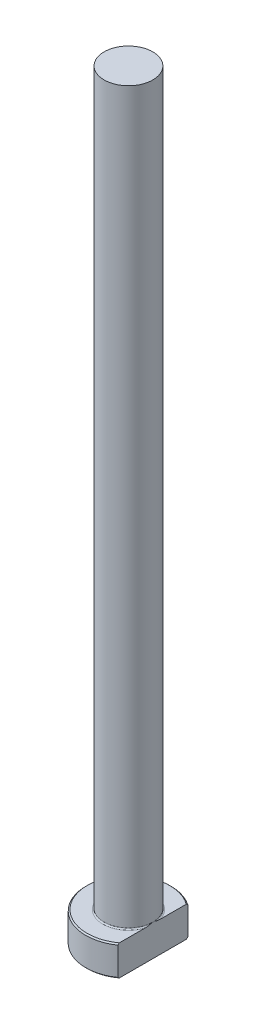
SolidWorks part; units mm, degrees
ref_plane "Front Plane" through (0, 0, 0) normal (0, 0, 1) x (1, 0, 0)
ref_plane "Top Plane" through (0, 0, 0) normal (0, 1, 0) x (1, 0, 0)
ref_plane "Right Plane" through (0, 0, 0) normal (1, 0, 0) x (0, 0, -1)
sketch "Sketch1" plane through (0, 0, 0) normal (0, 0, 1) x (1, 0, 0)
  line L0 (0, 259.9588) -> (0, -15.1925) construction
  line L1 (0, 0) -> (-7, 0)
  line L2 (-7, 0) -> (-7, 5)
  line L3 (-7, 5) -> (-4, 5)
  line L4 (-4, 5) -> (-4, 125)
  line L5 (-4, 125) -> (0, 125)
  line L6 (0, 125) -> (0, 0)
  dimension "L" = 125
  dimension "H" = 14
  dimension "T" = 5
  dimension "D" = 8
revolve "Revolve1" add sketch "Sketch1" angle 360 about L0
chamfer "Chamfer1" distance 0.2 angle 45 2 edges at (0, 5, 7) (0, 0, 7)
fillet "Fillet1" radius 0.2 1 edges at (0, 5, 4)
sketch "Sketch2" plane through (0, 0, 0) normal (0, 1, 0) x (1, 0, 0)
  line L0 (4, 5.7446) -> (4, -5.7446)
  circle A0 centre (0, 0) radius 7 construction
  arc A1 (4, -5.7446) -> (4, 5.7446) centre (0, 0) ccw
  circle A2 centre (0, 0) radius 4 construction
extrude "KEY" cut sketch "Sketch2" along normal through all
